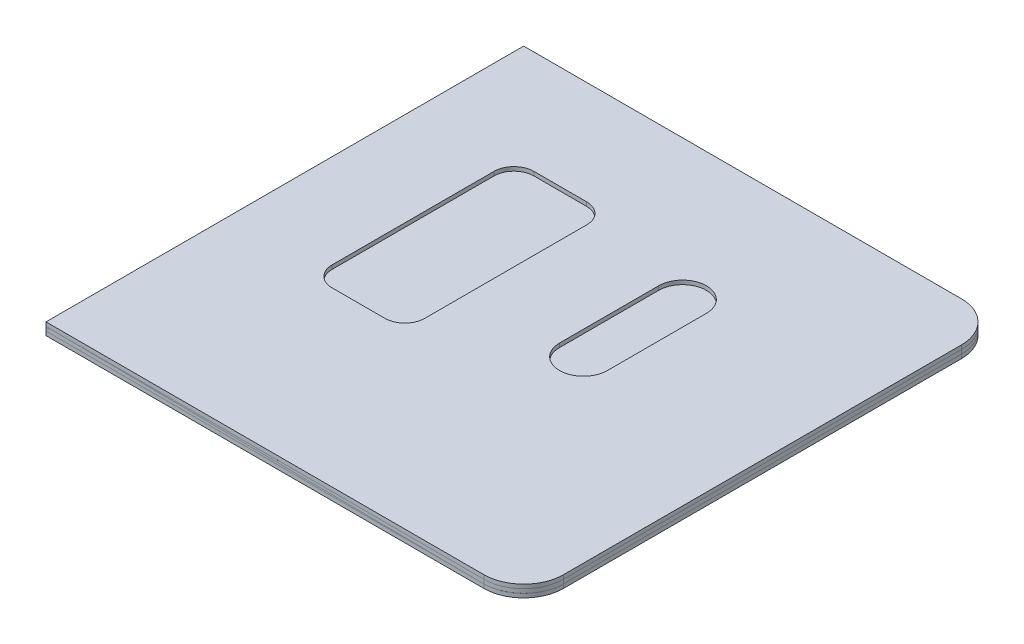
SolidWorks part; units mm, degrees
other "Page 4 Slider"
ref_plane "Front Plane" through (0, 0, 0) normal (0, 0, 1) x (1, 0, 0)
ref_plane "Top Plane" through (0, 0, 0) normal (0, 1, 0) x (1, 0, 0)
ref_plane "Right Plane" through (0, 0, 0) normal (1, 0, 0) x (0, 0, -1)
sketch "Sketch1" plane through (0, 0, 0) normal (0, 1, 0) x (1, 0, 0)
  line L0 (-60.0396, 59.8042) -> (49.9604, 59.8042)
  line L1 (59.9604, 49.8042) -> (59.9604, -50.1958)
  line L2 (49.9604, -60.1958) -> (-60.0396, -60.1958)
  line L3 (-60.0396, -60.1958) -> (-60.0396, 59.8042)
  spline S0 degree 3 poles (49.9604, 59.8042) (55.4682, 59.8042) (59.9604, 55.312) (59.9604, 49.8042) knots 0.166667 0.166667 0.166667 0.166667 0.333333 0.333333 0.333333 0.333333
  spline S1 degree 3 poles (59.9604, -50.1958) (59.9604, -55.7036) (55.4682, -60.1958) (49.9604, -60.1958) knots 0.5 0.5 0.5 0.5 0.666667 0.666667 0.666667 0.666667
  dimension "D1" = 110
  dimension "D2" = 120
extrude "Boss-Extrude1" add sketch "Sketch1" along normal blind 1
sketch "Sketch3" plane through (0, 1, 0) normal (0, 1, 0) x (1, 0, 0)
  line L0 (38.8713, 59.8041) -> (49.9606, 59.8041)
  line L1 (59.9604, 49.8043) -> (59.9604, -50.1961)
  line L2 (49.9606, -60.1959) -> (-60.0396, -60.1959)
  line L3 (-60.0396, -60.1959) -> (-60.0396, 59.8041)
  line L4 (-38.958, 59.8043) -> (-38.958, 50.6465)
  line L5 (-38.958, 50.6465) -> (-49.0124, 50.6465)
  line L6 (-49.0124, 50.6465) -> (-49.0124, 1.9696)
  line L7 (-49.0124, 1.9696) -> (-39.0328, 1.9696)
  line L8 (-39.0328, 1.9696) -> (-39.0328, -43.285)
  line L9 (-39.0328, -43.285) -> (36.5862, -43.285)
  line L10 (36.5862, 1.9696) -> (46.6406, 1.9696)
  line L11 (46.6406, 1.9696) -> (46.6406, 50.6463)
  line L12 (46.6406, 50.6463) -> (38.8713, 50.6463)
  line L13 (38.8713, 50.6463) -> (38.8713, 59.8041)
  line L14 (36.5862, 1.9696) -> (36.5862, -43.285)
  spline S0 degree 3 poles (49.9606, 59.8041) (55.4602, 59.8041) (59.9604, 55.3037) (59.9604, 49.8043) knots 0.055556 0.055556 0.055556 0.055556 0.111111 0.111111 0.111111 0.111111
  spline S1 degree 3 poles (59.9604, -50.1961) (59.9604, -55.6957) (55.4602, -60.1959) (49.9606, -60.1959) knots 0.166667 0.166667 0.166667 0.166667 0.222222 0.222222 0.222222 0.222222
  spline S2 degree 3 poles (-60.0396, 59.8041) (-53.0124, 59.8042) (-45.9853, 59.8043) (-38.958, 59.8043) knots 0.333333 0.333333 0.333333 0.333333 0.388889 0.388889 0.388889 0.388889
extrude "Boss-Extrude3" add sketch "Sketch3" along normal blind 1 separate body
sketch "Sketch4" plane through (0, 1, 0) normal (0, 1, 0) x (1, 0, 0)
  line L0 (38.8713, 59.8041) -> (49.9606, 59.8041)
  line L1 (59.9604, 49.8043) -> (59.9604, -50.1961)
  line L2 (49.9606, -60.1959) -> (-60.0396, -60.1959)
  line L3 (-60.0396, -60.1959) -> (-60.0396, 59.8041)
  line L4 (-38.958, 59.8043) -> (-38.958, 50.6465)
  line L5 (-38.958, 50.6465) -> (-49.0124, 50.6465)
  line L6 (-49.0124, 50.6465) -> (-49.0125, 1.9696)
  line L7 (-49.0125, 1.9696) -> (-39.0329, 1.9696)
  line L8 (-39.0329, 1.9696) -> (-39.0592, -43.285)
  line L9 (-39.0592, -43.285) -> (36.5598, -43.285)
  line L10 (36.5597, 1.9696) -> (46.6141, 1.9696)
  line L11 (46.6141, 1.9696) -> (46.6141, 50.6463)
  line L12 (46.6141, 50.6463) -> (38.8713, 50.6463)
  line L13 (38.8713, 50.6463) -> (38.8713, 59.8041)
  spline S0 degree 3 poles (49.9606, 59.8041) (55.4602, 59.8041) (59.9604, 55.3037) (59.9604, 49.8043) knots 0.055556 0.055556 0.055556 0.055556 0.111111 0.111111 0.111111 0.111111
  spline S1 degree 3 poles (59.9604, -50.1961) (59.9604, -55.6957) (55.4602, -60.1959) (49.9606, -60.1959) knots 0.166667 0.166667 0.166667 0.166667 0.222222 0.222222 0.222222 0.222222
  spline S2 degree 3 poles (-60.0396, 59.8041) (-53.0124, 59.8042) (-45.9853, 59.8043) (-38.958, 59.8043) knots 0.333333 0.333333 0.333333 0.333333 0.388889 0.388889 0.388889 0.388889
  spline S3 degree 3 poles (36.5598, -43.285) (36.5598, -28.2091) (36.5597, -13.1063) (36.5597, 1.9696) knots 0.722222 0.722222 0.722222 0.722222 0.777778 0.777778 0.777778 0.777778
extrude "Boss-Extrude4" add sketch "Sketch4" along normal blind 1 separate body
sketch "Sketch5" plane through (0, 1, 0) normal (0, 1, 0) x (1, 0, 0)
  line L0 (36.5597, -43.2847) -> (-39.0591, -43.2851)
  line L1 (-39.0591, -43.2851) -> (-39.0326, 1.9696)
  line L2 (-39.0326, 1.9696) -> (-49.0124, 1.9696)
  line L3 (-49.0124, 1.9696) -> (-49.0124, 25.7505)
  line L4 (-49.0124, 25.7505) -> (-38.958, 25.7505)
  line L5 (-38.958, 25.7505) -> (-38.958, 34.9083)
  line L6 (-38.958, 34.9083) -> (-6.707, 34.9083)
  line L7 (-6.707, 34.9083) -> (-5.6541, 35.5808)
  line L8 (-5.3985, 38.0124) -> (-8.6923, 41.2565)
  line L9 (-8.0667, 43.1823) -> (-3.495, 43.8708)
  line L10 (-2.2725, 45.9883) -> (-3.962, 50.2917)
  line L11 (-2.6072, 51.7964) -> (1.8493, 50.5661)
  line L12 (3.8275, 52.0032) -> (4.0343, 56.6217)
  line L13 (5.8841, 57.4454) -> (9.4549, 54.5087)
  line L14 (11.8465, 55.0171) -> (13.9139, 59.152)
  line L15 (15.9388, 59.1522) -> (18.0064, 55.0171)
  line L16 (20.398, 54.5087) -> (23.9687, 57.4454)
  line L17 (25.8185, 56.6218) -> (26.0254, 52.0032)
  line L18 (28.0035, 50.5661) -> (32.4599, 51.7965)
  line L19 (33.8149, 50.2918) -> (32.1253, 45.9883)
  line L20 (33.3479, 43.8708) -> (37.9194, 43.1823)
  line L21 (38.5452, 41.2566) -> (35.2514, 38.0123)
  line L22 (35.507, 35.5806) -> (36.5597, 34.9083)
  line L23 (36.5597, 34.9083) -> (36.5597, 25.7503)
  line L24 (36.5597, 25.7503) -> (46.6141, 25.7503)
  line L25 (46.6141, 25.7503) -> (46.6141, 1.9696)
  line L26 (46.6141, 1.9696) -> (36.5597, 1.9696)
  line L27 (36.5597, 1.9696) -> (36.5597, -43.2847)
  line L28 (23.0626, -32.7046) -> (23.0626, -7.8353)
  line L29 (7.0634, -7.8353) -> (6.9935, -32.7046)
  line L30 (6.9935, -32.7046) -> (23.0626, -32.7046)
  line L31 (23.0626, 34.9083) -> (7.0634, 34.9083)
  line L32 (7.0634, 34.9083) -> (7.0634, 7.2637)
  line L33 (23.0626, 7.2637) -> (23.0626, 34.9083)
  circle A0 centre (15.0631, -0.2858) radius 5
  spline S0 degree 3 poles (-5.6541, 35.5808) (-5.2394, 35.8457) (-4.9922, 36.2456) (-4.9407, 36.7351) knots 0.137931 0.137931 0.137931 0.137931 0.155172 0.155172 0.155172 0.155172
  spline S1 degree 3 poles (-4.9407, 36.7351) (-4.8893, 37.2245) (-5.0479, 37.667) (-5.3985, 38.0124) knots 0.155172 0.155172 0.155172 0.155172 0.172414 0.172414 0.172414 0.172414
  spline S2 degree 3 poles (-8.6923, 41.2565) (-9.0054, 41.5648) (-9.1103, 41.9948) (-8.9745, 42.4128) knots 0.189655 0.189655 0.189655 0.189655 0.206897 0.206897 0.206897 0.206897
  spline S3 degree 3 poles (-8.9745, 42.4128) (-8.8387, 42.8307) (-8.5012, 43.1169) (-8.0667, 43.1823) knots 0.206897 0.206897 0.206897 0.206897 0.224138 0.224138 0.224138 0.224138
  spline S4 degree 3 poles (-3.495, 43.8708) (-3.0084, 43.9442) (-2.6199, 44.209) (-2.3738, 44.6352) knots 0.241379 0.241379 0.241379 0.241379 0.258621 0.258621 0.258621 0.258621
  spline S5 degree 3 poles (-2.3738, 44.6352) (-2.1277, 45.0614) (-2.0926, 45.5302) (-2.2725, 45.9883) knots 0.258621 0.258621 0.258621 0.258621 0.275862 0.275862 0.275862 0.275862
  spline S6 degree 3 poles (-3.962, 50.2917) (-4.1226, 50.7006) (-4.0436, 51.1362) (-3.7495, 51.4628) knots 0.293103 0.293103 0.293103 0.293103 0.310345 0.310345 0.310345 0.310345
  spline S7 degree 3 poles (-3.7495, 51.4628) (-3.4555, 51.7893) (-3.0306, 51.9135) (-2.6072, 51.7964) knots 0.310345 0.310345 0.310345 0.310345 0.327586 0.327586 0.327586 0.327586
  spline S8 degree 3 poles (1.8493, 50.5661) (2.3237, 50.4351) (2.7864, 50.519) (3.1845, 50.8083) knots 0.344828 0.344828 0.344828 0.344828 0.362069 0.362069 0.362069 0.362069
  spline S9 degree 3 poles (3.1845, 50.8083) (3.5826, 51.0976) (3.8054, 51.5116) (3.8275, 52.0032) knots 0.362069 0.362069 0.362069 0.362069 0.37931 0.37931 0.37931 0.37931
  spline S10 degree 3 poles (4.0343, 56.6217) (4.0539, 57.0606) (4.3032, 57.4264) (4.7048, 57.6052) knots 0.396552 0.396552 0.396552 0.396552 0.413793 0.413793 0.413793 0.413793
  spline S11 degree 3 poles (4.7048, 57.6052) (5.1062, 57.7839) (5.5448, 57.7245) (5.8841, 57.4454) knots 0.413793 0.413793 0.413793 0.413793 0.431034 0.431034 0.431034 0.431034
  spline S12 degree 3 poles (9.4549, 54.5087) (9.835, 54.1961) (10.2917, 54.0846) (10.7731, 54.1869) knots 0.448276 0.448276 0.448276 0.448276 0.465517 0.465517 0.465517 0.465517
  spline S13 degree 3 poles (10.7731, 54.1869) (11.2545, 54.2893) (11.6264, 54.5769) (11.8465, 55.0171) knots 0.465517 0.465517 0.465517 0.465517 0.482759 0.482759 0.482759 0.482759
  spline S14 degree 3 poles (13.9139, 59.152) (14.1104, 59.5451) (14.4869, 59.7779) (14.9264, 59.7779) knots 0.5 0.5 0.5 0.5 0.517241 0.517241 0.517241 0.517241
  spline S15 degree 3 poles (14.9264, 59.7779) (15.3659, 59.7779) (15.7424, 59.5452) (15.9388, 59.1522) knots 0.517241 0.517241 0.517241 0.517241 0.534483 0.534483 0.534483 0.534483
  spline S16 degree 3 poles (18.0064, 55.0171) (18.2265, 54.5769) (18.5984, 54.2893) (19.0798, 54.1869) knots 0.551724 0.551724 0.551724 0.551724 0.568966 0.568966 0.568966 0.568966
  spline S17 degree 3 poles (19.0798, 54.1869) (19.5612, 54.0846) (20.0179, 54.1961) (20.398, 54.5087) knots 0.568966 0.568966 0.568966 0.568966 0.586207 0.586207 0.586207 0.586207
  spline S18 degree 3 poles (23.9687, 57.4454) (24.3081, 57.7245) (24.7467, 57.7839) (25.1479, 57.6052) knots 0.603448 0.603448 0.603448 0.603448 0.62069 0.62069 0.62069 0.62069
  spline S19 degree 3 poles (25.1479, 57.6052) (25.5495, 57.4264) (25.7988, 57.0608) (25.8185, 56.6218) knots 0.62069 0.62069 0.62069 0.62069 0.637931 0.637931 0.637931 0.637931
  spline S20 degree 3 poles (26.0254, 52.0032) (26.0474, 51.5116) (26.2702, 51.0976) (26.6683, 50.8083) knots 0.655172 0.655172 0.655172 0.655172 0.672414 0.672414 0.672414 0.672414
  spline S21 degree 3 poles (26.6683, 50.8083) (27.0665, 50.519) (27.529, 50.4351) (28.0035, 50.5661) knots 0.672414 0.672414 0.672414 0.672414 0.689655 0.689655 0.689655 0.689655
  spline S22 degree 3 poles (32.4599, 51.7965) (32.8835, 51.9135) (33.3084, 51.7893) (33.6022, 51.4629) knots 0.706897 0.706897 0.706897 0.706897 0.724138 0.724138 0.724138 0.724138
  spline S23 degree 3 poles (33.6022, 51.4629) (33.8963, 51.1362) (33.9755, 50.7008) (33.8149, 50.2918) knots 0.724138 0.724138 0.724138 0.724138 0.741379 0.741379 0.741379 0.741379
  spline S24 degree 3 poles (32.1253, 45.9883) (31.9454, 45.5301) (31.9806, 45.0613) (32.2267, 44.6351) knots 0.758621 0.758621 0.758621 0.758621 0.775862 0.775862 0.775862 0.775862
  spline S25 degree 3 poles (32.2267, 44.6351) (32.4728, 44.2089) (32.8613, 43.944) (33.3479, 43.8708) knots 0.775862 0.775862 0.775862 0.775862 0.793103 0.793103 0.793103 0.793103
  spline S26 degree 3 poles (37.9194, 43.1823) (38.354, 43.1169) (38.6917, 42.8307) (38.8273, 42.4129) knots 0.810345 0.810345 0.810345 0.810345 0.827586 0.827586 0.827586 0.827586
  spline S27 degree 3 poles (38.8273, 42.4129) (38.9631, 41.9948) (38.8583, 41.5649) (38.5452, 41.2566) knots 0.827586 0.827586 0.827586 0.827586 0.844828 0.844828 0.844828 0.844828
  spline S28 degree 3 poles (35.2514, 38.0123) (34.9008, 37.6669) (34.7421, 37.2244) (34.7936, 36.7349) knots 0.862069 0.862069 0.862069 0.862069 0.87931 0.87931 0.87931 0.87931
  spline S29 degree 3 poles (34.7936, 36.7349) (34.845, 36.2454) (35.0921, 35.8456) (35.507, 35.5806) knots 0.87931 0.87931 0.87931 0.87931 0.896552 0.896552 0.896552 0.896552
  spline S30 degree 3 poles (23.0626, -7.8353) (21.057, -9.9597) (18.215, -11.2858) (15.063, -11.2858) knots 0.2 0.2 0.2 0.2 0.4 0.4 0.4 0.4
  spline S31 degree 3 poles (15.063, -11.2858) (11.911, -11.2858) (9.069, -9.9597) (7.0634, -7.8353) knots 0.4 0.4 0.4 0.4 0.6 0.6 0.6 0.6
  spline S32 degree 3 poles (7.0634, 7.2637) (9.069, 9.3881) (11.911, 10.7142) (15.063, 10.7142) knots 0.4 0.4 0.4 0.4 0.6 0.6 0.6 0.6
  spline S33 degree 3 poles (15.063, 10.7142) (18.215, 10.7142) (21.057, 9.3881) (23.0626, 7.2637) knots 0.6 0.6 0.6 0.6 0.8 0.8 0.8 0.8
  spline S34 degree 3 poles (15.063, 4.7142) (12.3017, 4.7142) (10.063, 2.4755) (10.063, -3.0471) (12.3017, -5.2858) (15.063, -5.2858) knots 0.5 0.5 0.5 0.5 0.75 0.75 1 1 1 1 construction
  spline S35 degree 3 poles (15.063, -5.2858) (17.8243, -5.2858) (20.063, -3.0471) (20.063, 2.4755) (17.8243, 4.7142) (15.063, 4.7142) knots 0 0 0 0 0.25 0.25 0.5 0.5 0.5 0.5 construction
  point P0 (20.055, 0)
extrude "Boss-Extrude5" add sketch "Sketch5" along normal blind 1 separate body
sketch "Sketch6" plane through (0, 2, 0) normal (0, 1, 0) x (1, 0, 0)
  line L0 (-60.0396, 59.8042) -> (49.9604, 59.8042)
  line L1 (59.9604, 49.8042) -> (59.9604, -50.1958)
  line L2 (49.9604, -60.1958) -> (-60.0396, -60.1958)
  line L3 (-60.0396, -60.1958) -> (-60.0396, 59.8042)
  line L4 (-31.5083, 33.8294) -> (-18.2259, 33.8294)
  line L5 (-13.2259, 28.8294) -> (-13.2259, -11.862)
  line L6 (-18.2259, -16.862) -> (-31.5083, -16.862)
  line L7 (-36.5083, -11.862) -> (-36.5083, 28.8294)
  spline S0 degree 3 poles (49.9604, 59.8042) (55.4682, 59.8042) (59.9604, 55.312) (59.9604, 49.8042) knots 0.166667 0.166667 0.166667 0.166667 0.333333 0.333333 0.333333 0.333333
  spline S1 degree 3 poles (59.9604, -50.1958) (59.9604, -55.7036) (55.4682, -60.1958) (49.9604, -60.1958) knots 0.5 0.5 0.5 0.5 0.666667 0.666667 0.666667 0.666667
  spline S2 degree 3 poles (-18.2259, 33.8294) (-15.4759, 33.8294) (-13.2259, 31.578) (-13.2259, 28.8294) knots 0.125 0.125 0.125 0.125 0.25 0.25 0.25 0.25
  spline S3 degree 3 poles (-13.2259, -11.862) (-13.2259, -14.6106) (-15.4773, -16.862) (-18.2259, -16.862) knots 0.375 0.375 0.375 0.375 0.5 0.5 0.5 0.5
  spline S4 degree 3 poles (-31.5083, -16.862) (-34.2569, -16.862) (-36.5083, -14.612) (-36.5083, -11.862) knots 0.625 0.625 0.625 0.625 0.75 0.75 0.75 0.75
  spline S5 degree 3 poles (-36.5083, 28.8294) (-36.5083, 31.5794) (-34.2583, 33.8294) (-31.5083, 33.8294) knots 0.875 0.875 0.875 0.875 1 1 1 1
extrude "Boss-Extrude6" add sketch "Sketch6" along normal blind 1 separate body
move or copy body "Body-Move/Copy1" bodies to move or copy 105 copy yes number of copies 1 translate (0, 0, 0)
move or copy body "Body-Move/Copy2" bodies to move or copy 105 placed by mates yes
sketch "Sketch10" plane through (0, 3, 0) normal (0, 1, 0) x (1, 0, 0)
  line L0 (15.0631, -0.2858) -> (15.0631, 24.6101) construction
  line L1 (9.0631, -0.2858) -> (9.0631, 24.6101)
  line L2 (21.0631, -0.2858) -> (21.0631, 24.6101)
  arc A0 (9.0631, -0.2858) -> (21.0631, -0.2858) centre (15.0631, -0.2858) ccw
  arc A1 (21.0631, 24.6101) -> (9.0631, 24.6101) centre (15.0631, 24.6101) ccw
  point P4 (15.0631, 12.1622)
extrude "Cut-Extrude1" cut sketch "Sketch10" against normal blind 1
delete or keep bodies "Body-Delete/Keep 1" type delete bodies bodies 108
delete or keep bodies "Body-Delete/Keep 2" type delete bodies bodies 107
